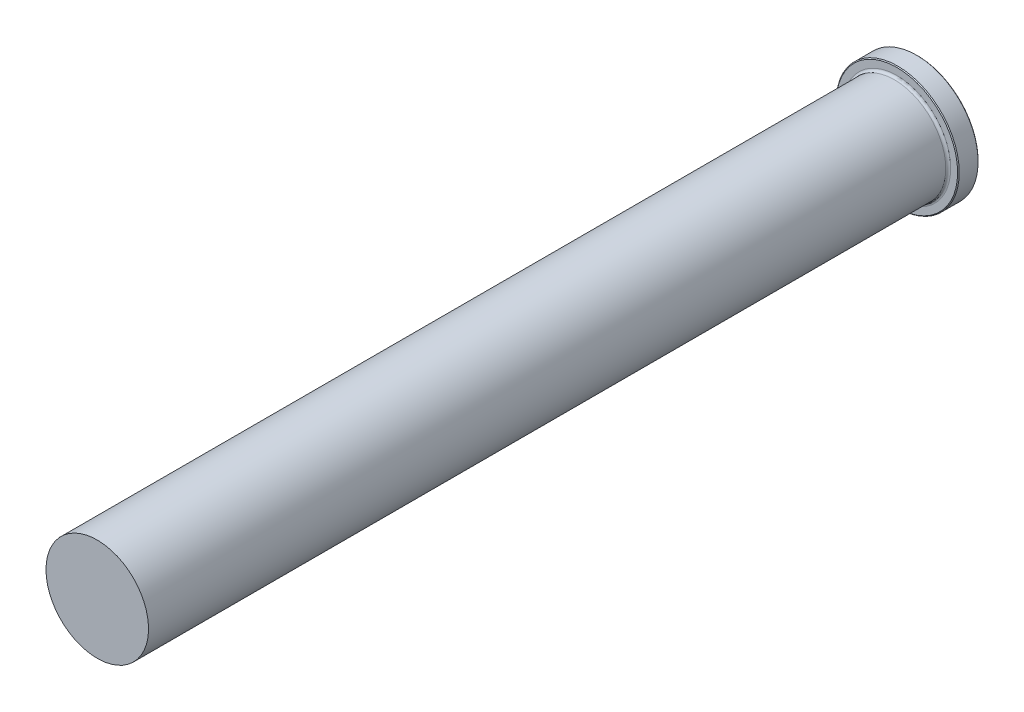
SolidWorks part; units mm, degrees
ref_plane "Front Plane" through (0, 0, 0) normal (0, 0, 1) x (1, 0, 0)
ref_plane "Top Plane" through (0, 0, 0) normal (0, 1, 0) x (1, 0, 0)
ref_plane "Right Plane" through (0, 0, 0) normal (1, 0, 0) x (0, 0, -1)
sketch "Sketch1" plane through (0, 0, 0) normal (1, 0, 0) x (0, 0, -1)
  line L0 (0, 0) -> (-156.8087, 0) construction
  line L1 (0, 0) -> (0, 19.05)
  line L2 (0, 19.05) -> (-6.35, 19.05)
  line L3 (-6.35, 19.05) -> (-6.35, 15.875)
  line L4 (-6.35, 15.875) -> (-254, 15.875)
  line L5 (-254, 15.875) -> (-254, 0)
  line L6 (-254, 0) -> (0, 0)
  dimension "D1" = 38.1
  dimension "D2" = 31.75
  dimension "D3" = 6.35
  dimension "D4" = 254
revolve "Revolve1" add sketch "Sketch1" angle 360 about L0
fillet "Fillet1" radius 0.762 1 edges at (-15.875, 0, 6.35)
chamfer "Chamfer1" distance 0.254 angle 45 2 edges at (-19.05, 0, 0) (-19.05, 0, 6.35)
